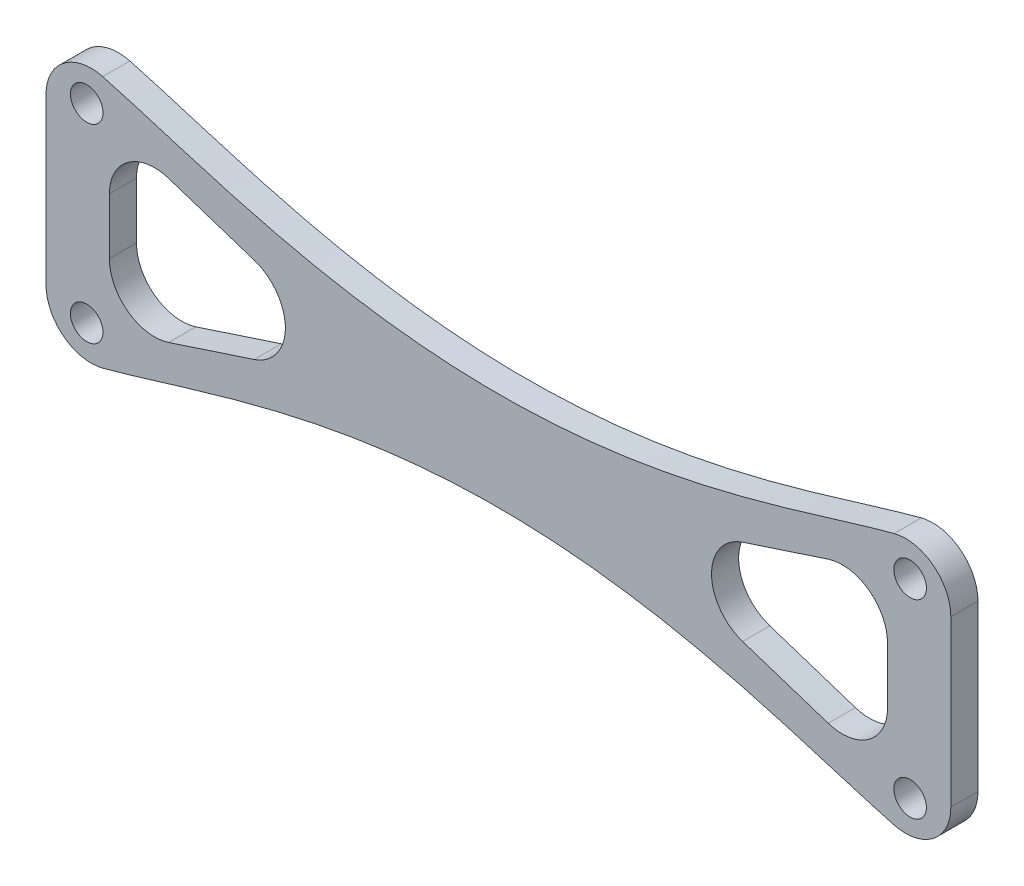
SolidWorks part; units mm, degrees
ref_plane "Plan de face" through (0, 0, 0) normal (0, 0, 1) x (1, 0, 0)
ref_plane "Plan de dessus" through (0, 0, 0) normal (0, 1, 0) x (1, 0, 0)
ref_plane "Plan de droite" through (0, 0, 0) normal (1, 0, 0) x (0, 0, -1)
sketch "Esquisse1" plane through (0, 0, 0) normal (0, 0, 1) x (1, 0, 0)
  line L0 (0, 0) -> (0, 30)
  line L1 (0, 0) -> (-100, 0)
  line L2 (0, 30) -> (-100, 30)
  line L3 (-100, 0) -> (-100, 30)
  line L4 (-4.5, 25.5) -> (-4.5, 4.5) construction
  line L5 (-4.5, 4.5) -> (-4.5, 0) construction
  line L6 (-95.5, 4.5) -> (-100, 4.5) construction
  line L7 (-95.5, 4.5) -> (-95.5, 0) construction
  line L8 (-95.5, 25.5) -> (-95.5, 30) construction
  line L9 (-95.5, 25.5) -> (-100, 25.5) construction
  line L10 (0, 25.5) -> (-4.5, 25.5) construction
  line L11 (-4.5, 25.5) -> (-95.5, 25.5) construction
  line L12 (-95.5, 25.5) -> (-95.5, 4.5) construction
  line L13 (-95.5, 4.5) -> (-4.5, 4.5) construction
  line L14 (-4.5, 4.5) -> (0, 4.5) construction
  line L15 (-4.5, 25.5) -> (-4.5, 30) construction
  line L16 (-85.5, 30) -> (-85.5, 0) construction
  line L17 (-14.5, 30) -> (-14.5, 0) construction
  line L18 (-100, 30) -> (-85.5, 30) construction
  line L19 (-85.5, 30) -> (-50, 4.5) construction
  line L20 (-50, 4.5) -> (-14.5, 30) construction
  line L21 (-14.5, 30) -> (0, 30) construction
  line L22 (-100, 0) -> (-85.5, 0) construction
  line L23 (-85.5, 0) -> (-50, 25.5) construction
  line L24 (-50, 25.5) -> (-14.5, 0) construction
  line L25 (-14.5, 0) -> (0, 0) construction
  line L26 (-100, 30) -> (0, 30)
  line L27 (0, 0) -> (-100, 0)
  line L28 (-37.5, 15) -> (-7, 25)
  line L29 (-7, 25) -> (-7, 5)
  line L30 (-7, 5) -> (-37.5, 15)
  line L31 (-93, 25) -> (-93, 5)
  line L32 (-93, 5) -> (-62.5, 15)
  line L33 (-62.5, 15) -> (-93, 25)
  line L34 (-93, 15) -> (-62.5, 15) construction
  line L35 (-73, 30) -> (-37.5, 30) construction
  line L36 (-37.5, 30) -> (-37.5, 15) construction
  line L37 (-7, 15) -> (-37.5, 15) construction
  line L38 (-62.5, 15) -> (-62.5, 30) construction
  line L39 (-62.5, 30) -> (-37.5, 15) construction
  line L40 (-37.5, 0) -> (-37.5, 15) construction
  line L41 (-62.5, 15) -> (-62.5, 0) construction
  circle A0 centre (-4.5, 25.5) radius 1.8
  circle A1 centre (-4.5, 4.5) radius 1.8
  circle A2 centre (-95.5, 25.5) radius 1.8
  circle A3 centre (-95.5, 4.5) radius 1.8
  spline_without_curve S0
  spline S1 degree 4 poles (-100, 0) (-85.5, 0) (-50, 25.5) (-14.5, 0) (0, 0) knots 0 0 0 0 0 1 1 1 1 1
  point P29 (-50, 25.5)
  point P39 (-50, 4.5)
  dimension "D4" = 3.6
  dimension "D1" = 100
  dimension "D2" = 30
  dimension "D3" = 21
  dimension "D5" = 10
  dimension "D6" = 10
  dimension "D7" = 5
  dimension "D8" = 5
  dimension "D9" = 5
  dimension "D10" = 5
  dimension "D11" = 25
  dimension "D12" = 7
  dimension "D14" = 7
extrude "Boss.-Extru.1" add sketch "Esquisse1" along normal blind 3 contours L3 S1 L0 S0 A3 A2 A1 A0
fillet "Congé1" radius 5 10 edges at (-100, 30, 1.5) (-100, 0, 1.5) (0, 0, 1.5) (0, 30, 1.5) (-7, 5, 1.5) (-7, 25, 1.5) (-37.5, 15, 1.5) (-62.5, 15, 1.5) (-93, 5, 1.5) (-93, 25, 1.5)
